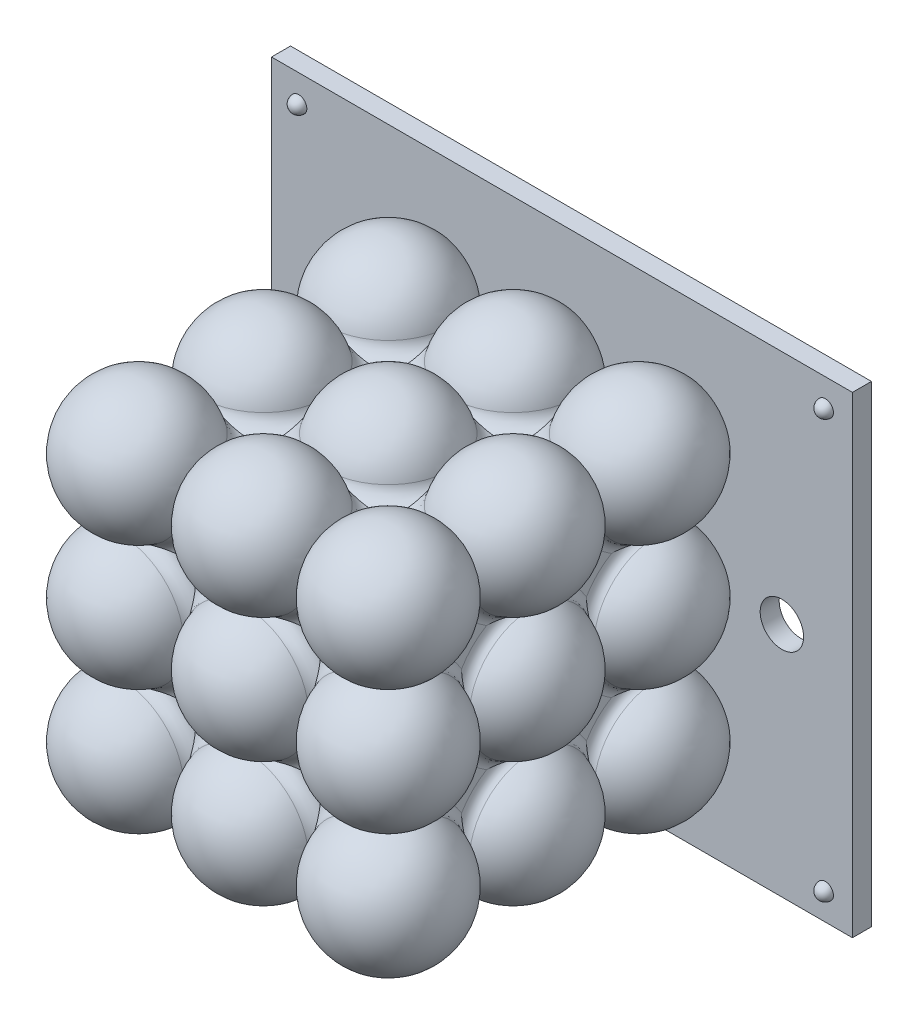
SolidWorks part; units mm, degrees
ref_plane "Alzado" through (0, 0, 0) normal (0, 0, 1) x (1, 0, 0)
ref_plane "Planta" through (0, 0, 0) normal (0, 1, 0) x (1, 0, 0)
ref_plane "Vista lateral" through (0, 0, 0) normal (1, 0, 0) x (0, 0, -1)
sketch "Sketch1" plane through (0, 0, 0) normal (0, 0, 1) x (1, 0, 0)
  line L0 (0, 20.5404) -> (0, -19.2001) construction
  line L1 (0, 12) -> (0, -12)
  arc A0 (0, -12) -> (0, 12) centre (0, 0) ccw
revolve "Revolve1" add sketch "Sketch1" angle 360 about L0
pattern_linear "LPattern3" count 3 spacing 23 along (1, 0, 0) of "Revolve1"
pattern_linear "LPattern4" count 3 spacing 23 along (0, 0, 1) of "LPattern3", "Revolve1"
pattern_linear "LPattern5" count 3 spacing 23 along (0, 1, 0) of "LPattern4", "Revolve1", "LPattern3"
ref_plane "Plane1" through (0, 0, -9) normal (0, 0, 1) x (1, 0, 0)
sketch "Sketch2" plane through (0, 0, 0) normal (1, 0, 0) x (0, 0, -1)
  line L0 (-46, 58) -> (0, 58) construction
  line L1 (-47, -1) -> (1, -1)
  line L2 (-47, -1) -> (-47, 47)
  line L3 (-47, 47) -> (1, 47)
  line L4 (1, -1) -> (1, 47)
  line L5 (-47, -1) -> (1, 47) construction
  line L6 (-47, 47) -> (1, -1) construction
  line L7 (12, 46) -> (12, 0) construction
  line L8 (-58, 46) -> (-58, 0) construction
  arc A0 (-34.5, 49.4278) -> (-49.4278, 34.5) centre (-46, 46) ccw construction
  arc A1 (-11.5, -3.4278) -> (3.4278, 11.5) centre (0, 0) ccw construction
  arc A3 (-49.4278, 11.5) -> (-34.5, -3.4278) centre (-46, 0) ccw construction
  arc A4 (3.4278, 34.5) -> (-11.5, 49.4278) centre (0, 46) ccw construction
  point P0 (-23, 23)
extrude "Boss-Extrude1" add sketch "Sketch2" along normal blind 48
sketch "Sketch3" plane through (0, 0, -9) normal (0, 0, 1) x (1, 0, 0)
  line L0 (0, 58) -> (46, 58) construction
  line L1 (-30.5, 66.5) -> (76.5, 66.5)
  line L2 (-30.5, 66.5) -> (-30.5, -20.5)
  line L3 (-30.5, -20.5) -> (76.5, -20.5)
  line L4 (76.5, 66.5) -> (76.5, -20.5)
  line L5 (-30.5, 66.5) -> (76.5, -20.5) construction
  line L6 (-30.5, -20.5) -> (76.5, 66.5) construction
  line L8 (-12, 46) -> (-12, 0) construction
  arc A0 (11.5, 49.4278) -> (-3.4278, 34.5) centre (0, 46) ccw construction
  arc A1 (49.4278, 34.5) -> (34.5, 49.4278) centre (46, 46) ccw construction
  arc A4 (11.5, 49.4278) -> (-3.4278, 34.5) centre (0, 46) ccw construction
  arc A5 (-3.4278, 11.5) -> (11.5, -3.4278) centre (0, 0) ccw construction
  point P0 (23, 23)
  dimension "D1" = 58
  dimension "D2" = 12
  dimension "D3" = 87
  dimension "D4" = 107
  dimension "D5" = 8.5
  dimension "D6" = 18.5
extrude "Boss-Extrude2" add sketch "Sketch3" against normal blind 3.5
sketch "Sketch4" plane through (0, 0, -12.5) normal (0, 0, -1) x (-1, 0, 0)
  line L0 (-76.5, 66.5) -> (30.5, 66.5) construction
  line L1 (-76.5, -20.5) -> (-76.5, 66.5) construction
  circle A0 centre (-63.5, 23) radius 4
  circle A1 centre (17.5, 23) radius 4
extrude "Cut-Extrude1" cut sketch "Sketch4" against normal blind 18
ref_plane "Plane2" through (0, 61.5, 0) normal (0, 1, 0) x (1, 0, 0)
sketch "Sketch5" plane through (0, 61.5, 0) normal (0, 1, 0) x (1, 0, 0)
  line L0 (76.5, 9) -> (-30.5, 9) construction
  line L1 (76.5, 12.5) -> (76.5, 9) construction
  line L3 (71.5, 10.5) -> (71.5, 7.5)
  arc A0 (71.5, 7.5) -> (71.5, 10.5) centre (71.5, 9) ccw
  dimension "D1" = 3
  dimension "D2" = 5
revolve "Revolve3" add sketch "Sketch5" angle 360 about L3
pattern_linear "LPattern6" count 2 spacing 77 along (0, -1, 0) count 2 spacing 97 along (-1, 0, 0) of "Revolve3"
fillet "Fillet1" radius 3 16 edges at (37.5442, 37.5442, 47) (14.5442, 31.4558, 47) (14.5442, 37.5442, 47) (8.4558, 37.5442, 47) (8.4558, 31.4558, 47) (37.5442, 8.4558, 47) (37.5442, 14.5442, 47) (31.4558, 14.5442, 47) (31.4558, 8.4558, 47) (14.5442, 8.4558, 47) (14.5442, 14.5442, 47) (8.4558, 14.5442, 47) (8.4558, 8.4558, 47) (31.4558, 37.5442, 47) (31.4558, 31.4558, 47) (37.5442, 31.4558, 47)
fillet "Fillet5" radius 3 16 edges at (31.4558, -1, 8.4558) (31.4558, -1, 31.4558) (14.5442, -1, 31.4558) (14.5442, -1, 14.5442) (31.4558, -1, 14.5442) (14.5442, -1, 37.5442) (31.4558, -1, 37.5442) (37.5442, -1, 8.4558) (8.4558, -1, 8.4558) (8.4558, -1, 14.5442) (14.5442, -1, 8.4558) (37.5442, -1, 31.4558) (37.5442, -1, 37.5442) (8.4558, -1, 31.4558) (8.4558, -1, 37.5442) (37.5442, -1, 14.5442)
fillet "Fillet6" radius 3 16 edges at (0, 31.4853, 31.4853) (0, 31.4853, 14.5147) (0, 14.5147, 14.5147) (0, 14.5147, 31.4853) (0, 31.4853, 8.4853) (0, 37.5147, 8.4853) (0, 31.4853, 37.5147) (0, 14.5147, 37.5147) (0, 37.5147, 31.4853) (0, 37.5147, 37.5147) (0, 8.4853, 14.5147) (0, 8.4853, 8.4853) (0, 14.5147, 8.4853) (0, 8.4853, 37.5147) (0, 8.4853, 31.4853) (0, 37.5147, 14.5147)
fillet "Fillet7" radius 3 16 edges at (37.5442, 47, 37.5442) (8.4558, 47, 37.5442) (14.5442, 47, 37.5442) (14.5442, 47, 31.4558) (8.4558, 47, 31.4558) (31.4558, 47, 14.5442) (37.5442, 47, 14.5442) (37.5442, 47, 8.4558) (31.4558, 47, 8.4558) (8.4558, 47, 14.5442) (14.5442, 47, 14.5442) (14.5442, 47, 8.4558) (8.4558, 47, 8.4558) (37.5442, 47, 31.4558) (31.4558, 47, 31.4558) (31.4558, 47, 37.5442)
fillet "Fillet8" radius 1.99 16 edges at (48, 37.6334, 37.6334) (48, 37.6334, 8.3666) (48, 37.6334, 14.6334) (48, 31.3666, 14.6334) (48, 31.3666, 8.3666) (48, 14.6334, 31.3666) (48, 14.6334, 37.6334) (48, 8.3666, 37.6334) (48, 8.3666, 31.3666) (48, 14.6334, 8.3666) (48, 14.6334, 14.6334) (48, 8.3666, 14.6334) (48, 8.3666, 8.3666) (48, 31.3666, 37.6334) (48, 31.3666, 31.3666) (48, 37.6334, 31.3666)
equation "\"diametro\"= 24"
equation "\"D1@Sketch1\"=\"diametro\""
equation "\"espacio\"= 23"
equation "\"D3@LPattern3\"=\"espacio\""
equation "\"cantidad\"= 3"
equation "\"D1@LPattern3\"=\"cantidad\""
equation "\"D3@LPattern4\"=\"espacio\""
equation "\"D1@LPattern4\"=\"cantidad\""
equation "\"D1@LPattern5\"=\"cantidad\""
equation "\"D3@LPattern5\"=\"espacio\""
equation "\"cuadrado\"= 48"
equation "\"D3@Sketch2\"=\"cuadrado\""
equation "\"D2@Sketch2\"=\"cuadrado\""
equation "\"hoyo\"= 8"
equation "\"D1@Sketch4\"=\"hoyo\""
equation "\"D2@Sketch4\"=\"hoyo\""
equation "\"D1@Boss-Extrude1\"=\"cuadrado\""
